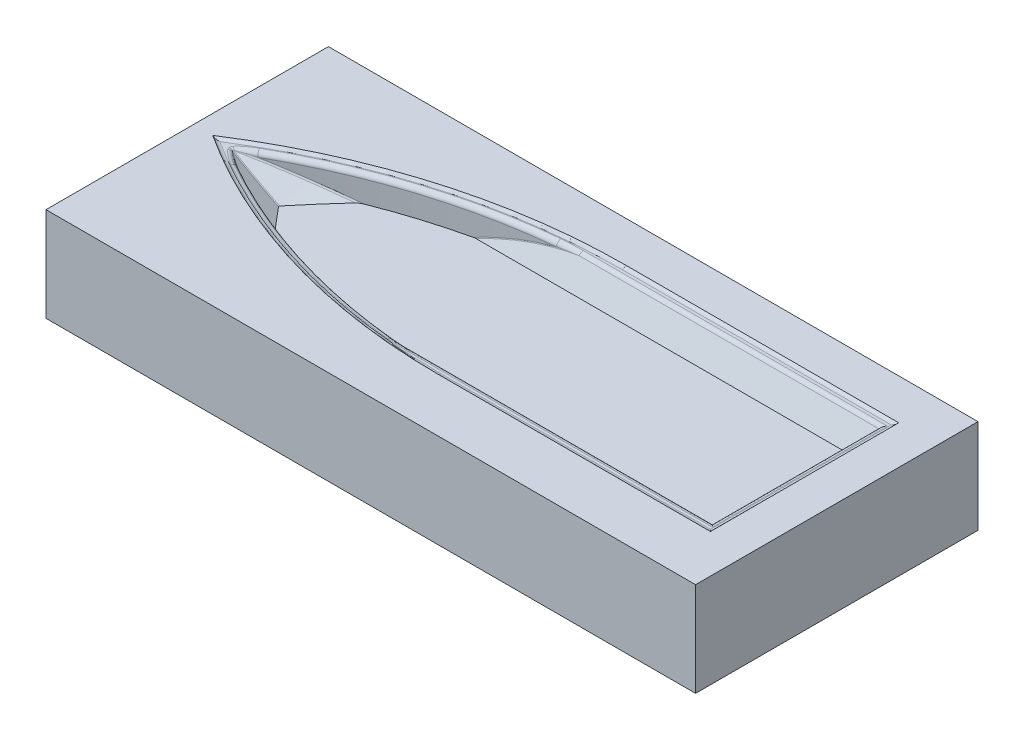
SolidWorks part; units mm, degrees
ref_plane "Front Plane" through (0, 0, 0) normal (0, 0, 1) x (1, 0, 0)
ref_plane "Top Plane" through (0, 0, 0) normal (0, 1, 0) x (1, 0, 0)
ref_plane "Right Plane" through (0, 0, 0) normal (1, 0, 0) x (0, 0, -1)
sketch "Sketch1" plane through (0, 0, 0) normal (0, 1, 0) x (1, 0, 0)
  line L0 (-400, 150) -> (400, -150) construction
  line L1 (-400, 150) -> (400, 150)
  line L2 (-400, 150) -> (-400, -150)
  line L3 (-400, -150) -> (400, -150)
  line L4 (400, 150) -> (400, -150)
  dimension "D1" = 800
  dimension "D2" = 300
extrude "Boss-Extrude1" add sketch "Sketch1" along normal blind 300
other "Cavity1"
other "Boat Deep V<1>@Assem11"
sketch "Sketch2" plane through (0, 0, 0) normal (0, -1, 0) x (-1, 0, 0)
  line L1 (-400, 150) -> (400, 150)
  line L2 (-400, 150) -> (-400, -150)
  line L3 (-400, -150) -> (400, -150)
  line L4 (400, 150) -> (400, -150)
extrude "Cut-Extrude1" cut sketch "Sketch2" against normal blind 150
sketch "Sketch3" plane through (-400, 0, 0) normal (-1, 0, 0) x (0, 0, 1)
  line L1 (-150, 150) -> (150, 150)
  line L2 (-150, 150) -> (-150, 300)
  line L3 (-150, 300) -> (150, 300)
  line L4 (150, 150) -> (150, 300)
extrude "Cut-Extrude2" cut sketch "Sketch3" against normal blind 80
sketch "Sketch4" plane through (400, 0, 0) normal (1, 0, 0) x (0, 0, -1)
  line L0 (-150, 300) -> (-150, 150) construction
  line L1 (150, 300) -> (-150, 300)
  line L2 (150, 300) -> (150, 150)
  line L3 (150, 150) -> (-150, 150)
  line L4 (-150, 300) -> (-150, 150)
extrude "Cut-Extrude3" cut sketch "Sketch4" against normal blind 30
sketch "Sketch6" plane through (0, 150, 0) normal (0, -1, 0) x (1, 0, 0)
  line L1 (-320, -150) -> (370, -150)
  line L2 (-320, -150) -> (-320, 150)
  line L3 (-320, 150) -> (370, 150)
  line L4 (370, -150) -> (370, 150)
extrude "Boss-Extrude2" add sketch "Sketch6" against normal blind 120
sketch "Sketch7" plane through (0, 150, 0) normal (0, -1, 0) x (1, 0, 0)
  line L1 (-320, -150) -> (370, -150)
  line L2 (-320, -150) -> (-320, 150)
  line L3 (-320, 150) -> (370, 150)
  line L4 (370, -150) -> (370, 150)
extrude "Cut-Extrude4" cut sketch "Sketch7" against normal blind 50
